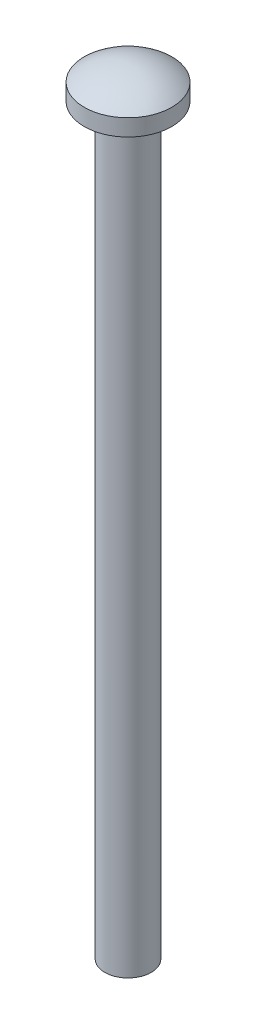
SolidWorks part; units mm, degrees
ref_plane "Front Plane" through (0, 0, 0) normal (0, 0, 1) x (1, 0, 0)
ref_plane "Top Plane" through (0, 0, 0) normal (0, 1, 0) x (1, 0, 0)
ref_plane "Right Plane" through (0, 0, 0) normal (1, 0, 0) x (0, 0, -1)
sketch "Sketch1" plane through (0, 0, 0) normal (0, 0, 1) x (1, 0, 0)
  line L0 (0, 0) -> (0, 4.445)
  line L1 (0, 0) -> (5.9944, 0)
  line L2 (5.9944, 0) -> (5.9944, 2.286)
  line L3 (0, 4.445) -> (-1.0583, 4.445) construction
  arc A0 (0, 4.445) -> (5.9944, 2.286) centre (0, -4.9561) cw
  dimension "D1" = 5.9944
  dimension "D2" = 4.445
  dimension "D3" = 2.286
revolve "Revolve1" add sketch "Sketch1" angle 360 about L0
sketch "Sketch2" plane through (0, 0, 0) normal (0, 1, 0) x (1, 0, 0)
  circle A0 centre (0, 0) radius 3.175
  dimension "D1" = 6.35
extrude "Boss-Extrude1" add sketch "Sketch2" against normal blind 101.6
